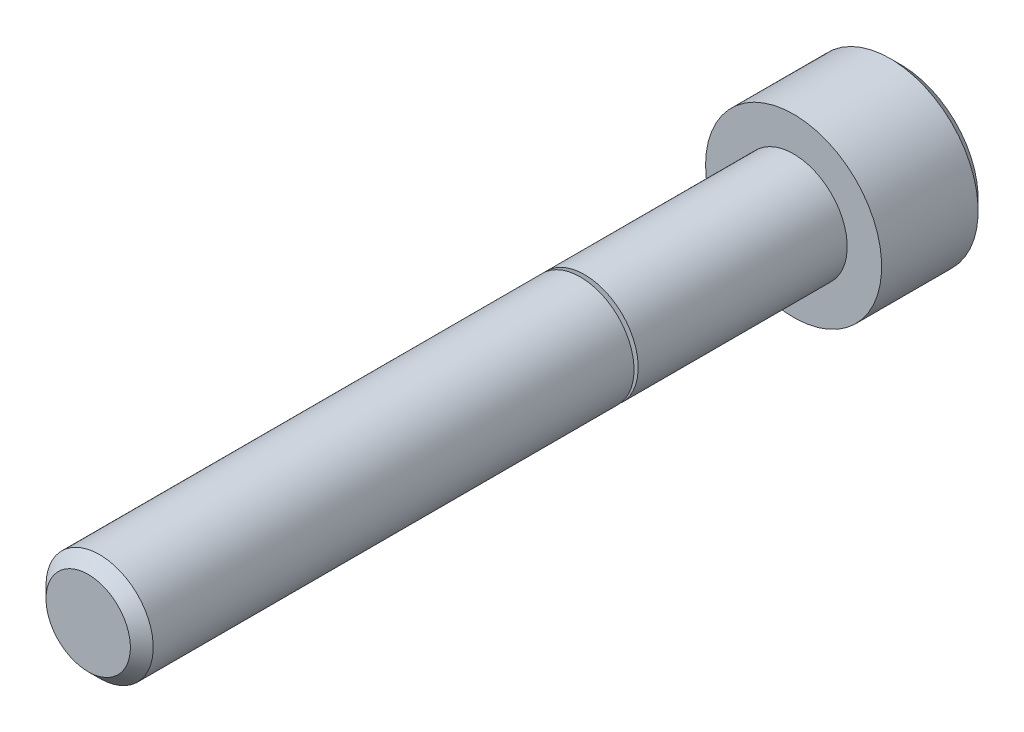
SolidWorks part; units mm, degrees
ref_plane "Front" through (0, 0, 0) normal (0, 0, 1) x (1, 0, 0)
ref_plane "Top" through (0, 0, 0) normal (0, 1, 0) x (1, 0, 0)
ref_plane "Right" through (0, 0, 0) normal (1, 0, 0) x (0, 0, -1)
sketch "Logo3_Revol_Axis" plane through (0, 0, 0) normal (0, 1, 0) x (1, 0, 0)
  line L0 (0, -43.5172) -> (0, 43.5172) construction
sketch "Logo3_bib1" plane through (0, 0, 0) normal (0, -1, 0) x (-1, 0, 0)
  line L0 (0, -31.75) -> (0, 4.826)
  line L1 (0, 4.826) -> (3.4798, 4.826)
  line L2 (3.9624, 4.3434) -> (3.9624, 0)
  line L3 (3.9624, 0) -> (2.413, 0)
  line L4 (2.413, 0) -> (2.413, -9.408)
  line L5 (2.413, -31.2356) -> (1.8987, -31.75)
  line L6 (1.8987, -31.75) -> (0, -31.75)
  line L7 (2.413, -9.408) -> (2.0121, -9.408)
  line L8 (2.0052, -9.4468) -> (2.413, -9.5952)
  line L9 (2.413, -9.5952) -> (2.413, -31.2356)
  line L10 (0, 10.5852) -> (0, -63.2873) construction
  line L11 (3.4798, 4.826) -> (3.9624, 4.3434)
  arc A1 (2.0121, -9.408) -> (2.0052, -9.4468) centre (2.0121, -9.428) ccw
  point P17 (1.8987, -9.408)
  point P19 (3.9624, 4.826)
revolve "Revolve1" add sketch "Logo3_bib1" angle 360 about L10
sketch "Logo3_bib2" plane through (0, 0, -4.826) normal (0, 0, -1) x (1, 0, 0)
  line L1 (2.2914, 0) -> (1.1457, 1.9844)
  line L2 (1.1457, 1.9844) -> (-1.1457, 1.9844)
  line L3 (-1.1457, 1.9844) -> (-2.2914, 0)
  line L4 (-2.2914, 0) -> (-1.1457, -1.9844)
  line L5 (-1.1457, -1.9844) -> (1.1457, -1.9844)
  line L6 (1.1457, -1.9844) -> (2.2914, 0)
  circle A0 centre (0, 0) radius 1.9844 construction
  dimension "Logo3_c1" = 3.9688
extrude "Cut-Extrude1" cut sketch "Logo3_bib2" against normal blind 2.413
equation "\"DIA2@Logo3_bib1\" = \"Logo3_d1-pas@Logo3_bib1\""
equation "\"LGT1@Logo3_bib1\" = \"Logo3_d1@Logo3_bib1\""
equation "\"D1@Cut-Extrude1\" = \"Logo3_d1@Logo3_bib1\"/2."
equation "\"D2@Cosmetic Thread1\" = \"Logo3_d1-pas@Logo3_bib1\""
equation "\"D5@Logo3_bib1\"=\"Logo3_d1@Logo3_bib1\"*.1"
